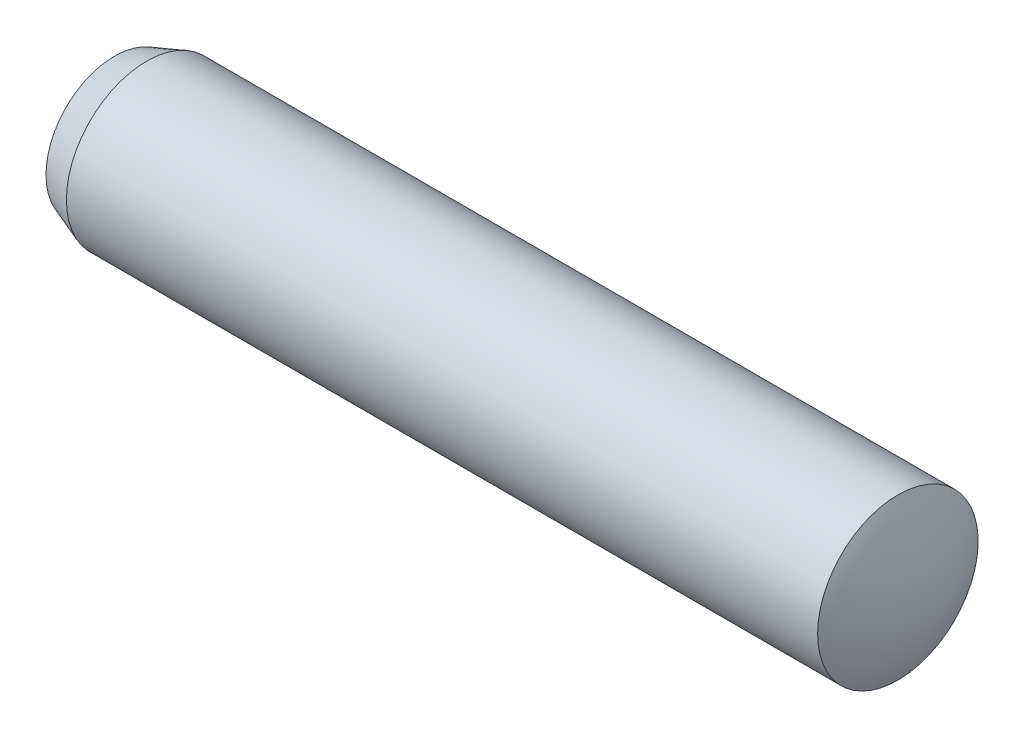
SolidWorks part; units mm, degrees
ref_plane "Plan1" through (0, 0, 0) normal (0, 0, 1) x (1, 0, 0)
ref_plane "Plan2" through (0, 0, 0) normal (0, 1, 0) x (1, 0, 0)
ref_plane "Plan3" through (0, 0, 0) normal (1, 0, 0) x (0, 0, -1)
sketch "Esquisse1" plane through (0, 0, 0) normal (0, 0, 1) x (1, 0, 0)
  line L0 (0, 0) -> (0, 4.2721)
  line L1 (0, 4.2721) -> (2, 5)
  line L2 (2, 5) -> (48.8, 5)
  line L3 (0, 0) -> (50, 0) construction
  line L4 (0, 0) -> (50, 0)
  arc A0 (48.8, 5) -> (50, 0) centre (38.9833, 0) cw
  dimension "D1" = 50
  dimension "D2" = 5
  dimension "D3" = 1.2
  dimension "D4" = 2
  dimension "D5" = 20
revolve "Base-Révolution" add sketch "Esquisse1" angle 360 about L3
